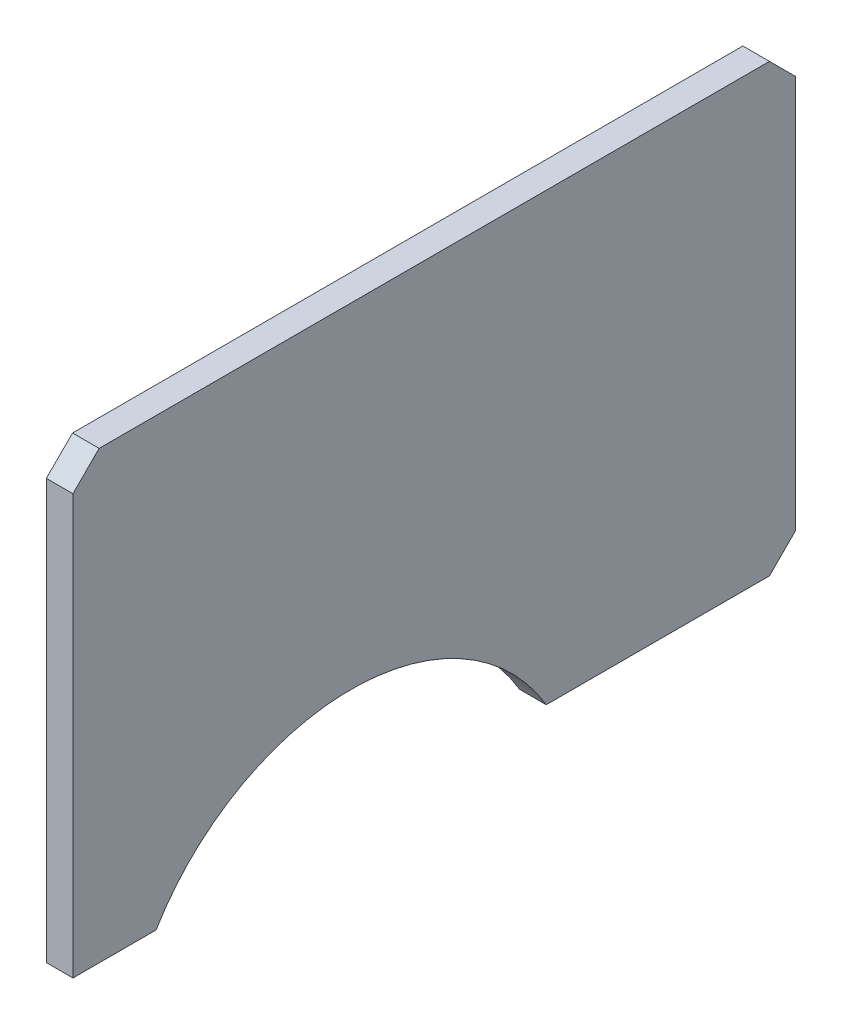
SolidWorks part; units mm, degrees
ref_plane "Front Plane" through (0, 0, 0) normal (0, 0, 1) x (1, 0, 0)
ref_plane "Top Plane" through (0, 0, 0) normal (0, 1, 0) x (1, 0, 0)
ref_plane "Right Plane" through (0, 0, 0) normal (1, 0, 0) x (0, 0, -1)
body saved out of another part "Stock-Piranha-h0400-4301-1"
sketch "Sketch1" plane through (388.0272, 0, 0) normal (1, 0, 0) x (0, 0, -1)
  line L0 (294.937, 181.6432) -> (297.937, 184.6432)
  line L1 (215.133, 181.6432) -> (296.937, 181.6432) construction
  line L2 (297.937, 182.6432) -> (297.937, 231.6972) construction
  line L3 (215.133, 229.6972) -> (218.133, 232.6972)
  line L4 (215.133, 231.6972) -> (215.133, 181.6432) construction
  line L5 (296.937, 232.6972) -> (216.133, 232.6972) construction
  line L6 (294.937, 232.6972) -> (297.937, 229.6972)
  line L7 (297.937, 229.6972) -> (297.937, 232.6972)
  line L8 (297.937, 232.6972) -> (294.937, 232.6972)
  line L9 (297.937, 184.6432) -> (297.937, 181.6432)
  line L10 (297.937, 181.6432) -> (294.937, 181.6432)
  line L11 (215.133, 229.6972) -> (215.133, 232.6972)
  line L12 (215.133, 232.6972) -> (218.133, 232.6972)
  dimension "D1" = 3
extrude "Cut-Extrude1" cut sketch "Sketch1" against normal through all
sketch "Sketch2" plane through (388.0272, 0, 0) normal (1, 0, 0) x (0, 0, -1)
  line L0 (215.133, 181.6432) -> (294.937, 181.6432) construction
  line L1 (269.362, 181.6432) -> (224.658, 181.6432)
  line L2 (247.01, 181.6432) -> (247.01, 194.3432) construction
  line L3 (215.133, 229.6972) -> (215.133, 181.6432) construction
  line L4 (297.937, 184.6432) -> (297.937, 229.6972) construction
  arc A0 (224.658, 181.6432) -> (269.362, 181.6432) centre (247.01, 168.3235) cw
  dimension "D1" = 12.7
  dimension "D2" = 9.525
  dimension "D3" = 28.575
extrude "Cut-Extrude2" cut sketch "Sketch2" against normal through all
